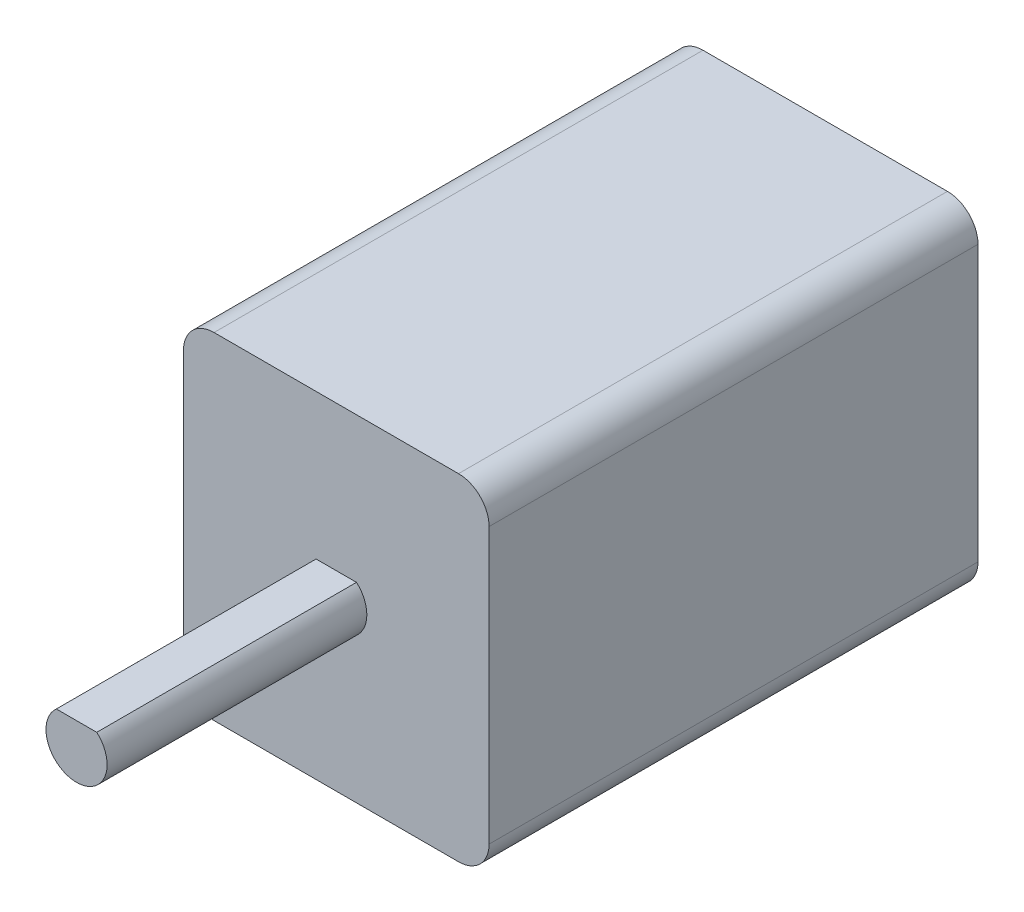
SolidWorks part; units mm, degrees
ref_plane "前视基准面" through (0, 0, 0) normal (0, 0, 1) x (1, 0, 0)
ref_plane "上视基准面" through (0, 0, 0) normal (0, 1, 0) x (1, 0, 0)
ref_plane "右视基准面" through (0, 0, 0) normal (1, 0, 0) x (0, 0, -1)
sketch "草图1" plane through (0, 0, 0) normal (0, 0, 1) x (1, 0, 0)
  line L1 (-10, -11) -> (10, -11)
  line L2 (-10, -11) -> (-10, 11)
  line L3 (-10, 11) -> (10, 11)
  line L4 (10, -11) -> (10, 11)
  line L5 (-10, -11) -> (10, 11) construction
  line L6 (-10, 11) -> (10, -11) construction
  point P0 (0, 0)
  dimension "D1" = 22
  dimension "D2" = 20
extrude "凸台-拉伸1" add sketch "草图1" along normal blind 32
fillet "圆角1" radius 2 4 edges at (10, -11, 16) (-10, -11, 16) (10, 11, 16) (-10, 11, 16)
sketch "草图2" plane through (0, 0, 32) normal (0, 0, 1) x (1, 0, 0)
  circle A0 centre (0, 0) radius 2
  dimension "D1" = 4
extrude "凸台-拉伸2" add sketch "草图2" along normal blind 17
sketch "草图3" plane through (0, 0, 49) normal (0, 0, 1) x (1, 0, 0)
  line L0 (-1.3229, 1.5) -> (1.3229, 1.5)
  circle A1 centre (0, 0) radius 2
  arc A2 (1.3229, 1.5) -> (-1.3229, 1.5) centre (0, 0) ccw
  dimension "D2" = 1.5
  dimension "D1" = 0
extrude "切除-拉伸1" cut sketch "草图3" against normal up to surface (17 mm away)
